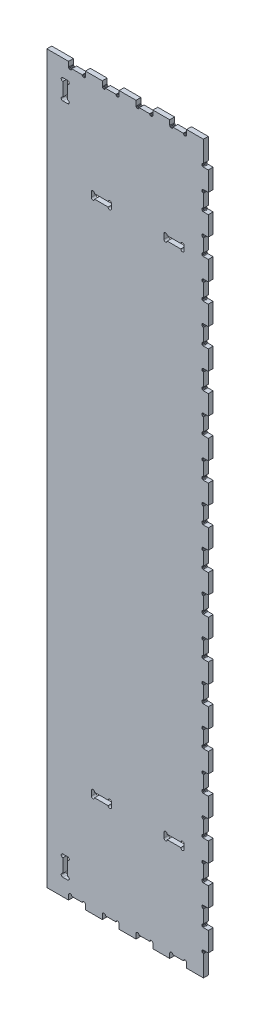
SolidWorks part; units mm, degrees
ref_plane "Спереди" through (0, 0, 0) normal (0, 0, 1) x (1, 0, 0)
ref_plane "Сверху" through (0, 0, 0) normal (0, 1, 0) x (1, 0, 0)
ref_plane "Справа" through (0, 0, 0) normal (1, 0, 0) x (0, 0, -1)
sketch "Sketch1" plane through (0, 0, 0) normal (0, 0, 1) x (1, 0, 0)
  line L0 (-145.404, -2312) -> (-145.288, -2312)
  line L1 (-145.288, -2312) -> (-145.288, -2311.04)
  line L2 (-145.288, -2311.04) -> (-144.398, -2309.35)
  line L3 (-144.398, -2309.35) -> (-142.823, -2308.26)
  line L4 (-142.823, -2308.26) -> (-140.922, -2308.03)
  line L5 (-140.922, -2308.03) -> (-139.132, -2308.71)
  line L6 (-139.132, -2308.71) -> (-137.862, -2310.14)
  line L7 (-137.862, -2310.14) -> (-137.404, -2312)
  line L8 (-137.404, -2312) -> (-111.51, -2312)
  line L9 (-111.51, -2312) -> (-111.51, -2311.04)
  line L10 (-111.51, -2311.04) -> (-110.62, -2309.35)
  line L11 (-110.62, -2309.35) -> (-109.045, -2308.26)
  line L12 (-109.045, -2308.26) -> (-107.144, -2308.03)
  line L13 (-107.144, -2308.03) -> (-105.354, -2308.71)
  line L14 (-105.354, -2308.71) -> (-104.085, -2310.14)
  line L15 (-104.085, -2310.14) -> (-103.626, -2312)
  line L16 (-103.626, -2312) -> (-103.626, -2324)
  line L17 (-103.626, -2324) -> (-61.8487, -2324)
  line L18 (-61.8487, -2324) -> (-61.8487, -2312)
  line L19 (-61.8487, -2312) -> (-61.7324, -2312)
  line L20 (-61.7324, -2312) -> (-61.7324, -2311.04)
  line L21 (-61.7324, -2311.04) -> (-60.8427, -2309.35)
  line L22 (-60.8427, -2309.35) -> (-59.2671, -2308.26)
  line L23 (-59.2671, -2308.26) -> (-57.3665, -2308.03)
  line L24 (-57.3665, -2308.03) -> (-55.5764, -2308.71)
  line L25 (-55.5764, -2308.71) -> (-54.3068, -2310.14)
  line L26 (-54.3068, -2310.14) -> (-53.8487, -2312)
  line L27 (-53.8487, -2312) -> (-27.9546, -2312)
  line L28 (-27.9546, -2312) -> (-27.9546, -2311.04)
  line L29 (-27.9546, -2311.04) -> (-27.0649, -2309.35)
  line L30 (-27.0649, -2309.35) -> (-25.4893, -2308.26)
  line L31 (-25.4893, -2308.26) -> (-23.5887, -2308.03)
  line L32 (-23.5887, -2308.03) -> (-21.7986, -2308.71)
  line L33 (-21.7986, -2308.71) -> (-20.5291, -2310.14)
  line L34 (-20.5291, -2310.14) -> (-20.0709, -2312)
  line L35 (-20.0709, -2312) -> (-20.0709, -2324)
  line L36 (-20.0709, -2324) -> (21.7069, -2324)
  line L37 (21.7069, -2324) -> (21.7069, -2312)
  line L38 (21.7069, -2312) -> (21.8231, -2312)
  line L39 (21.8231, -2312) -> (21.8231, -2311.04)
  line L40 (21.8231, -2311.04) -> (22.7128, -2309.35)
  line L41 (22.7128, -2309.35) -> (24.2885, -2308.26)
  line L42 (24.2885, -2308.26) -> (26.189, -2308.03)
  line L43 (26.189, -2308.03) -> (27.9791, -2308.71)
  line L44 (27.9791, -2308.71) -> (29.2487, -2310.14)
  line L45 (29.2487, -2310.14) -> (29.7069, -2312)
  line L46 (29.7069, -2312) -> (55.6009, -2312)
  line L47 (55.6009, -2312) -> (55.6009, -2311.04)
  line L48 (55.6009, -2311.04) -> (56.4906, -2309.35)
  line L49 (56.4906, -2309.35) -> (58.0662, -2308.26)
  line L50 (58.0662, -2308.26) -> (59.9668, -2308.03)
  line L51 (59.9668, -2308.03) -> (61.7569, -2308.71)
  line L52 (61.7569, -2308.71) -> (63.0265, -2310.14)
  line L53 (63.0265, -2310.14) -> (63.4847, -2312)
  line L54 (63.4847, -2312) -> (63.4847, -2324)
  line L55 (63.4847, -2324) -> (105.262, -2324)
  line L56 (105.262, -2324) -> (105.262, -2312)
  line L57 (105.262, -2312) -> (105.379, -2312)
  line L58 (105.379, -2312) -> (105.379, -2311.04)
  line L59 (105.379, -2311.04) -> (106.268, -2309.35)
  line L60 (106.268, -2309.35) -> (107.844, -2308.26)
  line L61 (107.844, -2308.26) -> (109.745, -2308.03)
  line L62 (109.745, -2308.03) -> (111.535, -2308.71)
  line L63 (111.535, -2308.71) -> (112.804, -2310.14)
  line L64 (112.804, -2310.14) -> (113.262, -2312)
  line L65 (113.262, -2312) -> (139.156, -2312)
  line L66 (139.156, -2312) -> (139.156, -2311.04)
  line L67 (139.156, -2311.04) -> (140.046, -2309.35)
  line L68 (140.046, -2309.35) -> (141.622, -2308.26)
  line L69 (141.622, -2308.26) -> (143.522, -2308.03)
  line L70 (143.522, -2308.03) -> (145.312, -2308.71)
  line L71 (145.312, -2308.71) -> (146.582, -2310.14)
  line L72 (146.582, -2310.14) -> (147.04, -2312)
  line L73 (147.04, -2312) -> (147.04, -2324)
  line L74 (147.04, -2324) -> (188.818, -2324)
  line L75 (188.818, -2324) -> (188.818, -2271.91)
  line L76 (188.818, -2271.91) -> (187.4, -2271.74)
  line L77 (187.4, -2271.74) -> (185.824, -2270.65)
  line L78 (185.824, -2270.65) -> (184.934, -2268.96)
  line L79 (184.934, -2268.96) -> (184.934, -2267.04)
  line L80 (184.934, -2267.04) -> (185.824, -2265.35)
  line L81 (185.824, -2265.35) -> (187.4, -2264.26)
  line L82 (187.4, -2264.26) -> (189.3, -2264.03)
  line L83 (189.3, -2264.03) -> (189.751, -2264.2)
  line L84 (189.751, -2264.2) -> (200.818, -2264.2)
  line L85 (200.818, -2264.2) -> (200.818, -2216)
  line L86 (200.818, -2216) -> (188.818, -2216)
  line L87 (188.818, -2216) -> (188.818, -2215.91)
  line L88 (188.818, -2215.91) -> (187.4, -2215.74)
  line L89 (187.4, -2215.74) -> (185.824, -2214.65)
  line L90 (185.824, -2214.65) -> (184.934, -2212.96)
  line L91 (184.934, -2212.96) -> (184.934, -2211.04)
  line L92 (184.934, -2211.04) -> (185.824, -2209.35)
  line L93 (185.824, -2209.35) -> (187.4, -2208.26)
  line L94 (187.4, -2208.26) -> (188.818, -2208.09)
  line L95 (188.818, -2208.09) -> (188.818, -2175.91)
  line L96 (188.818, -2175.91) -> (187.4, -2175.74)
  line L97 (187.4, -2175.74) -> (185.824, -2174.65)
  line L98 (185.824, -2174.65) -> (184.934, -2172.96)
  line L99 (184.934, -2172.96) -> (184.934, -2171.04)
  line L100 (184.934, -2171.04) -> (185.824, -2169.35)
  line L101 (185.824, -2169.35) -> (187.4, -2168.26)
  line L102 (187.4, -2168.26) -> (189.3, -2168.03)
  line L103 (189.3, -2168.03) -> (189.751, -2168.2)
  line L104 (189.751, -2168.2) -> (200.818, -2168.2)
  line L105 (200.818, -2168.2) -> (200.818, -2120)
  line L106 (200.818, -2120) -> (188.818, -2120)
  line L107 (188.818, -2120) -> (188.818, -2119.91)
  line L108 (188.818, -2119.91) -> (187.4, -2119.74)
  line L109 (187.4, -2119.74) -> (185.824, -2118.65)
  line L110 (185.824, -2118.65) -> (184.934, -2116.96)
  line L111 (184.934, -2116.96) -> (184.934, -2115.04)
  line L112 (184.934, -2115.04) -> (185.824, -2113.35)
  line L113 (185.824, -2113.35) -> (187.4, -2112.26)
  line L114 (187.4, -2112.26) -> (188.818, -2112.09)
  line L115 (188.818, -2112.09) -> (188.818, -2079.91)
  line L116 (188.818, -2079.91) -> (187.4, -2079.74)
  line L117 (187.4, -2079.74) -> (185.824, -2078.65)
  line L118 (185.824, -2078.65) -> (184.934, -2076.96)
  line L119 (184.934, -2076.96) -> (184.934, -2075.04)
  line L120 (184.934, -2075.04) -> (185.824, -2073.35)
  line L121 (185.824, -2073.35) -> (187.4, -2072.26)
  line L122 (187.4, -2072.26) -> (189.3, -2072.03)
  line L123 (189.3, -2072.03) -> (189.751, -2072.2)
  line L124 (189.751, -2072.2) -> (200.818, -2072.2)
  line L125 (200.818, -2072.2) -> (200.818, -2024)
  line L126 (200.818, -2024) -> (188.818, -2024)
  line L127 (188.818, -2024) -> (188.818, -2023.91)
  line L128 (188.818, -2023.91) -> (187.4, -2023.74)
  line L129 (187.4, -2023.74) -> (185.824, -2022.65)
  line L130 (185.824, -2022.65) -> (184.934, -2020.96)
  line L131 (184.934, -2020.96) -> (184.934, -2019.04)
  line L132 (184.934, -2019.04) -> (185.824, -2017.35)
  line L133 (185.824, -2017.35) -> (187.4, -2016.26)
  line L134 (187.4, -2016.26) -> (188.818, -2016.09)
  line L135 (188.818, -2016.09) -> (188.818, -1983.91)
  line L136 (188.818, -1983.91) -> (187.4, -1983.74)
  line L137 (187.4, -1983.74) -> (185.824, -1982.65)
  line L138 (185.824, -1982.65) -> (184.934, -1980.96)
  line L139 (184.934, -1980.96) -> (184.934, -1979.04)
  line L140 (184.934, -1979.04) -> (185.824, -1977.35)
  line L141 (185.824, -1977.35) -> (187.4, -1976.26)
  line L142 (187.4, -1976.26) -> (189.3, -1976.03)
  line L143 (189.3, -1976.03) -> (189.751, -1976.2)
  line L144 (189.751, -1976.2) -> (200.818, -1976.2)
  line L145 (200.818, -1976.2) -> (200.818, -1928)
  line L146 (200.818, -1928) -> (188.818, -1928)
  line L147 (188.818, -1928) -> (188.818, -1927.91)
  line L148 (188.818, -1927.91) -> (187.4, -1927.74)
  line L149 (187.4, -1927.74) -> (185.824, -1926.65)
  line L150 (185.824, -1926.65) -> (184.934, -1924.96)
  line L151 (184.934, -1924.96) -> (184.934, -1923.04)
  line L152 (184.934, -1923.04) -> (185.824, -1921.35)
  line L153 (185.824, -1921.35) -> (187.4, -1920.26)
  line L154 (187.4, -1920.26) -> (188.818, -1920.09)
  line L155 (188.818, -1920.09) -> (188.818, -1887.91)
  line L156 (188.818, -1887.91) -> (187.4, -1887.74)
  line L157 (187.4, -1887.74) -> (185.824, -1886.65)
  line L158 (185.824, -1886.65) -> (184.934, -1884.96)
  line L159 (184.934, -1884.96) -> (184.934, -1883.04)
  line L160 (184.934, -1883.04) -> (185.824, -1881.35)
  line L161 (185.824, -1881.35) -> (187.4, -1880.26)
  line L162 (187.4, -1880.26) -> (189.3, -1880.03)
  line L163 (189.3, -1880.03) -> (189.751, -1880.2)
  line L164 (189.751, -1880.2) -> (200.818, -1880.2)
  line L165 (200.818, -1880.2) -> (200.818, -1832)
  line L166 (200.818, -1832) -> (188.818, -1832)
  line L167 (188.818, -1832) -> (188.818, -1831.91)
  line L168 (188.818, -1831.91) -> (187.4, -1831.74)
  line L169 (187.4, -1831.74) -> (185.824, -1830.65)
  line L170 (185.824, -1830.65) -> (184.934, -1828.96)
  line L171 (184.934, -1828.96) -> (184.934, -1827.04)
  line L172 (184.934, -1827.04) -> (185.824, -1825.35)
  line L173 (185.824, -1825.35) -> (187.4, -1824.26)
  line L174 (187.4, -1824.26) -> (188.818, -1824.09)
  line L175 (188.818, -1824.09) -> (188.818, -1791.91)
  line L176 (188.818, -1791.91) -> (187.4, -1791.74)
  line L177 (187.4, -1791.74) -> (185.824, -1790.65)
  line L178 (185.824, -1790.65) -> (184.934, -1788.96)
  line L179 (184.934, -1788.96) -> (184.934, -1787.04)
  line L180 (184.934, -1787.04) -> (185.824, -1785.35)
  line L181 (185.824, -1785.35) -> (187.4, -1784.26)
  line L182 (187.4, -1784.26) -> (189.3, -1784.03)
  line L183 (189.3, -1784.03) -> (189.751, -1784.2)
  line L184 (189.751, -1784.2) -> (200.818, -1784.2)
  line L185 (200.818, -1784.2) -> (200.818, -1736)
  line L186 (200.818, -1736) -> (188.818, -1736)
  line L187 (188.818, -1736) -> (188.818, -1735.91)
  line L188 (188.818, -1735.91) -> (187.4, -1735.74)
  line L189 (187.4, -1735.74) -> (185.824, -1734.65)
  line L190 (185.824, -1734.65) -> (184.934, -1732.96)
  line L191 (184.934, -1732.96) -> (184.934, -1731.04)
  line L192 (184.934, -1731.04) -> (185.824, -1729.35)
  line L193 (185.824, -1729.35) -> (187.4, -1728.26)
  line L194 (187.4, -1728.26) -> (188.818, -1728.09)
  line L195 (188.818, -1728.09) -> (188.818, -1695.91)
  line L196 (188.818, -1695.91) -> (187.4, -1695.74)
  line L197 (187.4, -1695.74) -> (185.824, -1694.65)
  line L198 (185.824, -1694.65) -> (184.934, -1692.96)
  line L199 (184.934, -1692.96) -> (184.934, -1691.04)
  line L200 (184.934, -1691.04) -> (185.824, -1689.35)
  line L201 (185.824, -1689.35) -> (187.4, -1688.26)
  line L202 (187.4, -1688.26) -> (189.3, -1688.03)
  line L203 (189.3, -1688.03) -> (189.751, -1688.2)
  line L204 (189.751, -1688.2) -> (200.818, -1688.2)
  line L205 (200.818, -1688.2) -> (200.818, -1640)
  line L206 (200.818, -1640) -> (188.818, -1640)
  line L207 (188.818, -1640) -> (188.818, -1639.91)
  line L208 (188.818, -1639.91) -> (187.4, -1639.74)
  line L209 (187.4, -1639.74) -> (185.824, -1638.65)
  line L210 (185.824, -1638.65) -> (184.934, -1636.96)
  line L211 (184.934, -1636.96) -> (184.934, -1635.04)
  line L212 (184.934, -1635.04) -> (185.824, -1633.35)
  line L213 (185.824, -1633.35) -> (187.4, -1632.26)
  line L214 (187.4, -1632.26) -> (188.818, -1632.09)
  line L215 (188.818, -1632.09) -> (188.818, -1599.91)
  line L216 (188.818, -1599.91) -> (187.4, -1599.74)
  line L217 (187.4, -1599.74) -> (185.824, -1598.65)
  line L218 (185.824, -1598.65) -> (184.934, -1596.96)
  line L219 (184.934, -1596.96) -> (184.934, -1595.04)
  line L220 (184.934, -1595.04) -> (185.824, -1593.35)
  line L221 (185.824, -1593.35) -> (187.4, -1592.26)
  line L222 (187.4, -1592.26) -> (189.3, -1592.03)
  line L223 (189.3, -1592.03) -> (189.751, -1592.2)
  line L224 (189.751, -1592.2) -> (200.818, -1592.2)
  line L225 (200.818, -1592.2) -> (200.818, -1544)
  line L226 (200.818, -1544) -> (188.818, -1544)
  line L227 (188.818, -1544) -> (188.818, -1543.91)
  line L228 (188.818, -1543.91) -> (187.4, -1543.74)
  line L229 (187.4, -1543.74) -> (185.824, -1542.65)
  line L230 (185.824, -1542.65) -> (184.934, -1540.96)
  line L231 (184.934, -1540.96) -> (184.934, -1539.04)
  line L232 (184.934, -1539.04) -> (185.824, -1537.35)
  line L233 (185.824, -1537.35) -> (187.4, -1536.26)
  line L234 (187.4, -1536.26) -> (188.818, -1536.09)
  line L235 (188.818, -1536.09) -> (188.818, -1503.91)
  line L236 (188.818, -1503.91) -> (187.4, -1503.74)
  line L237 (187.4, -1503.74) -> (185.824, -1502.65)
  line L238 (185.824, -1502.65) -> (184.934, -1500.96)
  line L239 (184.934, -1500.96) -> (184.934, -1499.04)
  line L240 (184.934, -1499.04) -> (185.824, -1497.35)
  line L241 (185.824, -1497.35) -> (187.4, -1496.26)
  line L242 (187.4, -1496.26) -> (189.3, -1496.03)
  line L243 (189.3, -1496.03) -> (189.751, -1496.2)
  line L244 (189.751, -1496.2) -> (200.818, -1496.2)
  line L245 (200.818, -1496.2) -> (200.818, -1448)
  line L246 (200.818, -1448) -> (188.818, -1448)
  line L247 (188.818, -1448) -> (188.818, -1447.91)
  line L248 (188.818, -1447.91) -> (187.4, -1447.74)
  line L249 (187.4, -1447.74) -> (185.824, -1446.65)
  line L250 (185.824, -1446.65) -> (184.934, -1444.96)
  line L251 (184.934, -1444.96) -> (184.934, -1443.04)
  line L252 (184.934, -1443.04) -> (185.824, -1441.35)
  line L253 (185.824, -1441.35) -> (187.4, -1440.26)
  line L254 (187.4, -1440.26) -> (188.818, -1440.09)
  line L255 (188.818, -1440.09) -> (188.818, -1407.91)
  line L256 (188.818, -1407.91) -> (187.4, -1407.74)
  line L257 (187.4, -1407.74) -> (185.824, -1406.65)
  line L258 (185.824, -1406.65) -> (184.934, -1404.96)
  line L259 (184.934, -1404.96) -> (184.934, -1403.04)
  line L260 (184.934, -1403.04) -> (185.824, -1401.35)
  line L261 (185.824, -1401.35) -> (187.4, -1400.26)
  line L262 (187.4, -1400.26) -> (189.3, -1400.03)
  line L263 (189.3, -1400.03) -> (189.751, -1400.2)
  line L264 (189.751, -1400.2) -> (200.818, -1400.2)
  line L265 (200.818, -1400.2) -> (200.818, -1352)
  line L266 (200.818, -1352) -> (188.818, -1352)
  line L267 (188.818, -1352) -> (188.818, -1351.91)
  line L268 (188.818, -1351.91) -> (187.4, -1351.74)
  line L269 (187.4, -1351.74) -> (185.824, -1350.65)
  line L270 (185.824, -1350.65) -> (184.934, -1348.96)
  line L271 (184.934, -1348.96) -> (184.934, -1347.04)
  line L272 (184.934, -1347.04) -> (185.824, -1345.35)
  line L273 (185.824, -1345.35) -> (187.4, -1344.26)
  line L274 (187.4, -1344.26) -> (188.818, -1344.09)
  line L275 (188.818, -1344.09) -> (188.818, -1311.91)
  line L276 (188.818, -1311.91) -> (187.4, -1311.74)
  line L277 (187.4, -1311.74) -> (185.824, -1310.65)
  line L278 (185.824, -1310.65) -> (184.934, -1308.96)
  line L279 (184.934, -1308.96) -> (184.934, -1307.04)
  line L280 (184.934, -1307.04) -> (185.824, -1305.35)
  line L281 (185.824, -1305.35) -> (187.4, -1304.26)
  line L282 (187.4, -1304.26) -> (189.3, -1304.03)
  line L283 (189.3, -1304.03) -> (189.751, -1304.2)
  line L284 (189.751, -1304.2) -> (200.818, -1304.2)
  line L285 (200.818, -1304.2) -> (200.818, -1256)
  line L286 (200.818, -1256) -> (188.818, -1256)
  line L287 (188.818, -1256) -> (188.818, -1255.91)
  line L288 (188.818, -1255.91) -> (187.4, -1255.74)
  line L289 (187.4, -1255.74) -> (185.824, -1254.65)
  line L290 (185.824, -1254.65) -> (184.934, -1252.96)
  line L291 (184.934, -1252.96) -> (184.934, -1251.04)
  line L292 (184.934, -1251.04) -> (185.824, -1249.35)
  line L293 (185.824, -1249.35) -> (187.4, -1248.26)
  line L294 (187.4, -1248.26) -> (188.818, -1248.09)
  line L295 (188.818, -1248.09) -> (188.818, -1215.91)
  line L296 (188.818, -1215.91) -> (187.4, -1215.74)
  line L297 (187.4, -1215.74) -> (185.824, -1214.65)
  line L298 (185.824, -1214.65) -> (184.934, -1212.96)
  line L299 (184.934, -1212.96) -> (184.934, -1211.04)
  line L300 (184.934, -1211.04) -> (185.824, -1209.35)
  line L301 (185.824, -1209.35) -> (187.4, -1208.26)
  line L302 (187.4, -1208.26) -> (189.3, -1208.03)
  line L303 (189.3, -1208.03) -> (189.751, -1208.2)
  line L304 (189.751, -1208.2) -> (200.818, -1208.2)
  line L305 (200.818, -1208.2) -> (200.818, -1160)
  line L306 (200.818, -1160) -> (188.818, -1160)
  line L307 (188.818, -1160) -> (188.818, -1159.91)
  line L308 (188.818, -1159.91) -> (187.4, -1159.74)
  line L309 (187.4, -1159.74) -> (185.824, -1158.65)
  line L310 (185.824, -1158.65) -> (184.934, -1156.96)
  line L311 (184.934, -1156.96) -> (184.934, -1155.04)
  line L312 (184.934, -1155.04) -> (185.824, -1153.35)
  line L313 (185.824, -1153.35) -> (187.4, -1152.26)
  line L314 (187.4, -1152.26) -> (188.818, -1152.09)
  line L315 (188.818, -1152.09) -> (188.818, -1119.91)
  line L316 (188.818, -1119.91) -> (187.4, -1119.74)
  line L317 (187.4, -1119.74) -> (185.824, -1118.65)
  line L318 (185.824, -1118.65) -> (184.934, -1116.96)
  line L319 (184.934, -1116.96) -> (184.934, -1115.04)
  line L320 (184.934, -1115.04) -> (185.824, -1113.35)
  line L321 (185.824, -1113.35) -> (187.4, -1112.26)
  line L322 (187.4, -1112.26) -> (189.3, -1112.03)
  line L323 (189.3, -1112.03) -> (189.751, -1112.2)
  line L324 (189.751, -1112.2) -> (200.818, -1112.2)
  line L325 (200.818, -1112.2) -> (200.818, -1064)
  line L326 (200.818, -1064) -> (188.818, -1064)
  line L327 (188.818, -1064) -> (188.818, -1063.91)
  line L328 (188.818, -1063.91) -> (187.4, -1063.74)
  line L329 (187.4, -1063.74) -> (185.824, -1062.65)
  line L330 (185.824, -1062.65) -> (184.934, -1060.96)
  line L331 (184.934, -1060.96) -> (184.934, -1059.04)
  line L332 (184.934, -1059.04) -> (185.824, -1057.35)
  line L333 (185.824, -1057.35) -> (187.4, -1056.26)
  line L334 (187.4, -1056.26) -> (188.818, -1056.09)
  line L335 (188.818, -1056.09) -> (188.818, -1023.91)
  line L336 (188.818, -1023.91) -> (187.4, -1023.74)
  line L337 (187.4, -1023.74) -> (185.824, -1022.65)
  line L338 (185.824, -1022.65) -> (184.934, -1020.96)
  line L339 (184.934, -1020.96) -> (184.934, -1019.04)
  line L340 (184.934, -1019.04) -> (185.824, -1017.35)
  line L341 (185.824, -1017.35) -> (187.4, -1016.26)
  line L342 (187.4, -1016.26) -> (189.3, -1016.03)
  line L343 (189.3, -1016.03) -> (189.751, -1016.2)
  line L344 (189.751, -1016.2) -> (200.818, -1016.2)
  line L345 (200.818, -1016.2) -> (200.818, -968)
  line L346 (200.818, -968) -> (188.818, -968)
  line L347 (188.818, -968) -> (188.818, -967.912)
  line L348 (188.818, -967.912) -> (187.4, -967.74)
  line L349 (187.4, -967.74) -> (185.824, -966.652)
  line L350 (185.824, -966.652) -> (184.934, -964.957)
  line L351 (184.934, -964.957) -> (184.934, -963.043)
  line L352 (184.934, -963.043) -> (185.824, -961.348)
  line L353 (185.824, -961.348) -> (187.4, -960.26)
  line L354 (187.4, -960.26) -> (188.818, -960.088)
  line L355 (188.818, -960.088) -> (188.818, -927.912)
  line L356 (188.818, -927.912) -> (187.4, -927.74)
  line L357 (187.4, -927.74) -> (185.824, -926.652)
  line L358 (185.824, -926.652) -> (184.934, -924.957)
  line L359 (184.934, -924.957) -> (184.934, -923.043)
  line L360 (184.934, -923.043) -> (185.824, -921.348)
  line L361 (185.824, -921.348) -> (187.4, -920.26)
  line L362 (187.4, -920.26) -> (189.3, -920.029)
  line L363 (189.3, -920.029) -> (189.751, -920.2)
  line L364 (189.751, -920.2) -> (200.818, -920.2)
  line L365 (200.818, -920.2) -> (200.818, -872)
  line L366 (200.818, -872) -> (188.818, -872)
  line L367 (188.818, -872) -> (188.818, -871.912)
  line L368 (188.818, -871.912) -> (187.4, -871.74)
  line L369 (187.4, -871.74) -> (185.824, -870.652)
  line L370 (185.824, -870.652) -> (184.934, -868.957)
  line L371 (184.934, -868.957) -> (184.934, -867.043)
  line L372 (184.934, -867.043) -> (185.824, -865.348)
  line L373 (185.824, -865.348) -> (187.4, -864.26)
  line L374 (187.4, -864.26) -> (188.818, -864.088)
  line L375 (188.818, -864.088) -> (188.818, -831.912)
  line L376 (188.818, -831.912) -> (187.4, -831.74)
  line L377 (187.4, -831.74) -> (185.824, -830.652)
  line L378 (185.824, -830.652) -> (184.934, -828.957)
  line L379 (184.934, -828.957) -> (184.934, -827.043)
  line L380 (184.934, -827.043) -> (185.824, -825.348)
  line L381 (185.824, -825.348) -> (187.4, -824.26)
  line L382 (187.4, -824.26) -> (189.3, -824.029)
  line L383 (189.3, -824.029) -> (189.751, -824.2)
  line L384 (189.751, -824.2) -> (200.818, -824.2)
  line L385 (200.818, -824.2) -> (200.818, -776)
  line L386 (200.818, -776) -> (188.818, -776)
  line L387 (188.818, -776) -> (188.818, -775.912)
  line L388 (188.818, -775.912) -> (187.4, -775.74)
  line L389 (187.4, -775.74) -> (185.824, -774.652)
  line L390 (185.824, -774.652) -> (184.934, -772.957)
  line L391 (184.934, -772.957) -> (184.934, -771.043)
  line L392 (184.934, -771.043) -> (185.824, -769.348)
  line L393 (185.824, -769.348) -> (187.4, -768.26)
  line L394 (187.4, -768.26) -> (188.818, -768.088)
  line L395 (188.818, -768.088) -> (188.818, -735.912)
  line L396 (188.818, -735.912) -> (187.4, -735.74)
  line L397 (187.4, -735.74) -> (185.824, -734.652)
  line L398 (185.824, -734.652) -> (184.934, -732.957)
  line L399 (184.934, -732.957) -> (184.934, -731.043)
  line L400 (184.934, -731.043) -> (185.824, -729.348)
  line L401 (185.824, -729.348) -> (187.4, -728.26)
  line L402 (187.4, -728.26) -> (189.3, -728.029)
  line L403 (189.3, -728.029) -> (189.751, -728.2)
  line L404 (189.751, -728.2) -> (200.818, -728.2)
  line L405 (200.818, -728.2) -> (200.818, -680)
  line L406 (200.818, -680) -> (188.818, -680)
  line L407 (188.818, -680) -> (188.818, -679.912)
  line L408 (188.818, -679.912) -> (187.4, -679.74)
  line L409 (187.4, -679.74) -> (185.824, -678.652)
  line L410 (185.824, -678.652) -> (184.934, -676.957)
  line L411 (184.934, -676.957) -> (184.934, -675.043)
  line L412 (184.934, -675.043) -> (185.824, -673.348)
  line L413 (185.824, -673.348) -> (187.4, -672.26)
  line L414 (187.4, -672.26) -> (188.818, -672.088)
  line L415 (188.818, -672.088) -> (188.818, -639.912)
  line L416 (188.818, -639.912) -> (187.4, -639.74)
  line L417 (187.4, -639.74) -> (185.824, -638.652)
  line L418 (185.824, -638.652) -> (184.934, -636.957)
  line L419 (184.934, -636.957) -> (184.934, -635.043)
  line L420 (184.934, -635.043) -> (185.824, -633.348)
  line L421 (185.824, -633.348) -> (187.4, -632.26)
  line L422 (187.4, -632.26) -> (189.3, -632.029)
  line L423 (189.3, -632.029) -> (189.751, -632.2)
  line L424 (189.751, -632.2) -> (200.818, -632.2)
  line L425 (200.818, -632.2) -> (200.818, -584)
  line L426 (200.818, -584) -> (188.818, -584)
  line L427 (188.818, -584) -> (188.818, -583.912)
  line L428 (188.818, -583.912) -> (187.4, -583.74)
  line L429 (187.4, -583.74) -> (185.824, -582.652)
  line L430 (185.824, -582.652) -> (184.934, -580.957)
  line L431 (184.934, -580.957) -> (184.934, -579.043)
  line L432 (184.934, -579.043) -> (185.824, -577.348)
  line L433 (185.824, -577.348) -> (187.4, -576.26)
  line L434 (187.4, -576.26) -> (188.818, -576.088)
  line L435 (188.818, -576.088) -> (188.818, -524)
  line L436 (188.818, -524) -> (147.04, -524)
  line L437 (147.04, -524) -> (147.04, -536)
  line L438 (147.04, -536) -> (146.582, -537.859)
  line L439 (146.582, -537.859) -> (145.312, -539.292)
  line L440 (145.312, -539.292) -> (143.522, -539.971)
  line L441 (143.522, -539.971) -> (141.622, -539.74)
  line L442 (141.622, -539.74) -> (140.046, -538.652)
  line L443 (140.046, -538.652) -> (139.156, -536.957)
  line L444 (139.156, -536.957) -> (139.156, -536)
  line L445 (139.156, -536) -> (113.262, -536)
  line L446 (113.262, -536) -> (112.804, -537.859)
  line L447 (112.804, -537.859) -> (111.535, -539.292)
  line L448 (111.535, -539.292) -> (109.745, -539.971)
  line L449 (109.745, -539.971) -> (107.844, -539.74)
  line L450 (107.844, -539.74) -> (106.268, -538.652)
  line L451 (106.268, -538.652) -> (105.379, -536.957)
  line L452 (105.379, -536.957) -> (105.379, -536)
  line L453 (105.379, -536) -> (105.262, -536)
  line L454 (105.262, -536) -> (105.262, -524)
  line L455 (105.262, -524) -> (63.4847, -524)
  line L456 (63.4847, -524) -> (63.4847, -536)
  line L457 (63.4847, -536) -> (63.0265, -537.859)
  line L458 (63.0265, -537.859) -> (61.7569, -539.292)
  line L459 (61.7569, -539.292) -> (59.9668, -539.971)
  line L460 (59.9668, -539.971) -> (58.0662, -539.74)
  line L461 (58.0662, -539.74) -> (56.4906, -538.652)
  line L462 (56.4906, -538.652) -> (55.6009, -536.957)
  line L463 (55.6009, -536.957) -> (55.6009, -536)
  line L464 (55.6009, -536) -> (29.7069, -536)
  line L465 (29.7069, -536) -> (29.2487, -537.859)
  line L466 (29.2487, -537.859) -> (27.9791, -539.292)
  line L467 (27.9791, -539.292) -> (26.189, -539.971)
  line L468 (26.189, -539.971) -> (24.2885, -539.74)
  line L469 (24.2885, -539.74) -> (22.7128, -538.652)
  line L470 (22.7128, -538.652) -> (21.8231, -536.957)
  line L471 (21.8231, -536.957) -> (21.8231, -536)
  line L472 (21.8231, -536) -> (21.7069, -536)
  line L473 (21.7069, -536) -> (21.7069, -524)
  line L474 (21.7069, -524) -> (-20.0709, -524)
  line L475 (-20.0709, -524) -> (-20.0709, -536)
  line L476 (-20.0709, -536) -> (-20.5291, -537.859)
  line L477 (-20.5291, -537.859) -> (-21.7986, -539.292)
  line L478 (-21.7986, -539.292) -> (-23.5887, -539.971)
  line L479 (-23.5887, -539.971) -> (-25.4893, -539.74)
  line L480 (-25.4893, -539.74) -> (-27.0649, -538.652)
  line L481 (-27.0649, -538.652) -> (-27.9546, -536.957)
  line L482 (-27.9546, -536.957) -> (-27.9546, -536)
  line L483 (-27.9546, -536) -> (-53.8487, -536)
  line L484 (-53.8487, -536) -> (-54.3068, -537.859)
  line L485 (-54.3068, -537.859) -> (-55.5764, -539.292)
  line L486 (-55.5764, -539.292) -> (-57.3665, -539.971)
  line L487 (-57.3665, -539.971) -> (-59.2671, -539.74)
  line L488 (-59.2671, -539.74) -> (-60.8427, -538.652)
  line L489 (-60.8427, -538.652) -> (-61.7324, -536.957)
  line L490 (-61.7324, -536.957) -> (-61.7324, -536)
  line L491 (-61.7324, -536) -> (-61.8487, -536)
  line L492 (-61.8487, -536) -> (-61.8487, -524)
  line L493 (-61.8487, -524) -> (-103.626, -524)
  line L494 (-103.626, -524) -> (-103.626, -536)
  line L495 (-103.626, -536) -> (-104.085, -537.859)
  line L496 (-104.085, -537.859) -> (-105.354, -539.292)
  line L497 (-105.354, -539.292) -> (-107.144, -539.971)
  line L498 (-107.144, -539.971) -> (-109.045, -539.74)
  line L499 (-109.045, -539.74) -> (-110.62, -538.652)
  line L500 (-110.62, -538.652) -> (-111.51, -536.957)
  line L501 (-111.51, -536.957) -> (-111.51, -536)
  line L502 (-111.51, -536) -> (-137.404, -536)
  line L503 (-137.404, -536) -> (-137.862, -537.859)
  line L504 (-137.862, -537.859) -> (-139.132, -539.292)
  line L505 (-139.132, -539.292) -> (-140.922, -539.971)
  line L506 (-140.922, -539.971) -> (-142.823, -539.74)
  line L507 (-142.823, -539.74) -> (-144.398, -538.652)
  line L508 (-144.398, -538.652) -> (-145.288, -536.957)
  line L509 (-145.288, -536.957) -> (-145.288, -536)
  line L510 (-145.288, -536) -> (-145.404, -536)
  line L511 (-145.404, -536) -> (-145.404, -524)
  line L512 (-145.404, -524) -> (-199.182, -524)
  line L513 (-199.182, -524) -> (-199.182, -2324)
  line L514 (-199.182, -2324) -> (-145.404, -2324)
  line L515 (-145.404, -2324) -> (-145.404, -2312)
  line L516 (-147.742, -2282) -> (-159.542, -2282)
  line L517 (-147.742, -2273.8) -> (-147.742, -2240.2)
  line L518 (-147.742, -2232) -> (-159.542, -2232)
  line L519 (-159.542, -2273.8) -> (-159.542, -2240.2)
  line L520 (-199.182, -524) -> (-199.182, -2324) construction
  line L521 (-199.182, -2324) -> (-198.8207, -2323.0371) construction
  line L522 (-199.182, -1424) -> (188.818, -1424) construction
  line L523 (-159.542, -574.2) -> (-159.542, -607.8)
  line L524 (-147.742, -616) -> (-159.542, -616)
  line L525 (-147.742, -574.2) -> (-147.742, -607.8)
  line L526 (-147.742, -566) -> (-159.542, -566)
  line L527 (99.018, -2072.2) -> (132.618, -2072.2)
  line L528 (140.818, -2060.2) -> (140.818, -2072)
  line L529 (99.018, -2060.4) -> (132.618, -2060.4)
  line L530 (90.818, -2060.4) -> (90.818, -2072.2)
  line L531 (-80.982, -2072.2) -> (-47.382, -2072.2)
  line L532 (-39.182, -2060.2) -> (-39.182, -2072)
  line L533 (-80.982, -2060.4) -> (-47.382, -2060.4)
  line L534 (-89.182, -2060.4) -> (-89.182, -2072.2)
  line L535 (-89.182, -787.6) -> (-89.182, -775.8)
  line L536 (-80.982, -787.6) -> (-47.382, -787.6)
  line L537 (-39.182, -787.8) -> (-39.182, -776)
  line L538 (-80.982, -775.8) -> (-47.382, -775.8)
  line L539 (90.818, -787.6) -> (90.818, -775.8)
  line L540 (99.018, -787.6) -> (132.618, -787.6)
  line L541 (140.818, -787.8) -> (140.818, -776)
  line L542 (99.018, -775.8) -> (132.618, -775.8)
  arc A0 (-147.742, -2232) -> (-147.742, -2240.2) centre (-147.742, -2236.1) cw
  arc A1 (-147.742, -2282) -> (-147.742, -2273.8) centre (-147.742, -2277.9) ccw
  arc A2 (-159.542, -2282) -> (-159.542, -2273.8) centre (-159.542, -2277.9) cw
  arc A3 (-159.542, -2232) -> (-159.542, -2240.2) centre (-159.542, -2236.1) ccw
  arc A4 (-159.542, -616) -> (-159.542, -607.8) centre (-159.542, -611.9) cw
  arc A5 (-159.542, -566) -> (-159.542, -574.2) centre (-159.542, -570.1) ccw
  arc A6 (-147.742, -566) -> (-147.742, -574.2) centre (-147.742, -570.1) cw
  arc A7 (-147.742, -616) -> (-147.742, -607.8) centre (-147.742, -611.9) ccw
  arc A8 (140.818, -2072) -> (132.618, -2072.2) centre (136.718, -2072.1) cw
  arc A9 (90.818, -2072.2) -> (99.018, -2072.2) centre (94.918, -2072.2) ccw
  arc A10 (90.818, -2060.4) -> (99.018, -2060.4) centre (94.918, -2060.4) cw
  arc A11 (140.818, -2060.2) -> (132.618, -2060.4) centre (136.718, -2060.3) ccw
  arc A12 (-39.182, -2072) -> (-47.382, -2072.2) centre (-43.282, -2072.1) cw
  arc A13 (-89.182, -2072.2) -> (-80.982, -2072.2) centre (-85.082, -2072.2) ccw
  arc A14 (-89.182, -2060.4) -> (-80.982, -2060.4) centre (-85.082, -2060.4) cw
  arc A15 (-39.182, -2060.2) -> (-47.382, -2060.4) centre (-43.282, -2060.3) ccw
  arc A16 (-39.182, -787.8) -> (-47.382, -787.6) centre (-43.282, -787.7) cw
  arc A17 (-89.182, -787.6) -> (-80.982, -787.6) centre (-85.082, -787.6) ccw
  arc A18 (-89.182, -775.8) -> (-80.982, -775.8) centre (-85.082, -775.8) cw
  arc A19 (-39.182, -776) -> (-47.382, -775.8) centre (-43.282, -775.9) ccw
  arc A20 (140.818, -787.8) -> (132.618, -787.6) centre (136.718, -787.7) cw
  arc A21 (90.818, -787.6) -> (99.018, -787.6) centre (94.918, -787.6) ccw
  arc A22 (90.818, -775.8) -> (99.018, -775.8) centre (94.918, -775.8) cw
  arc A23 (140.818, -776) -> (132.618, -775.8) centre (136.718, -775.9) ccw
  dimension "D3" = 4.1
  dimension "D1" = 11.8
  dimension "D2" = 50
  dimension "D4" = 39.64
  dimension "D5" = 30
  dimension "D6" = 2
  dimension "D7" = 60
  dimension "D8" = 240
  dimension "D9" = 251.8
extrude "Boss-Extrude1" add sketch "Sketch1" along normal blind 12
